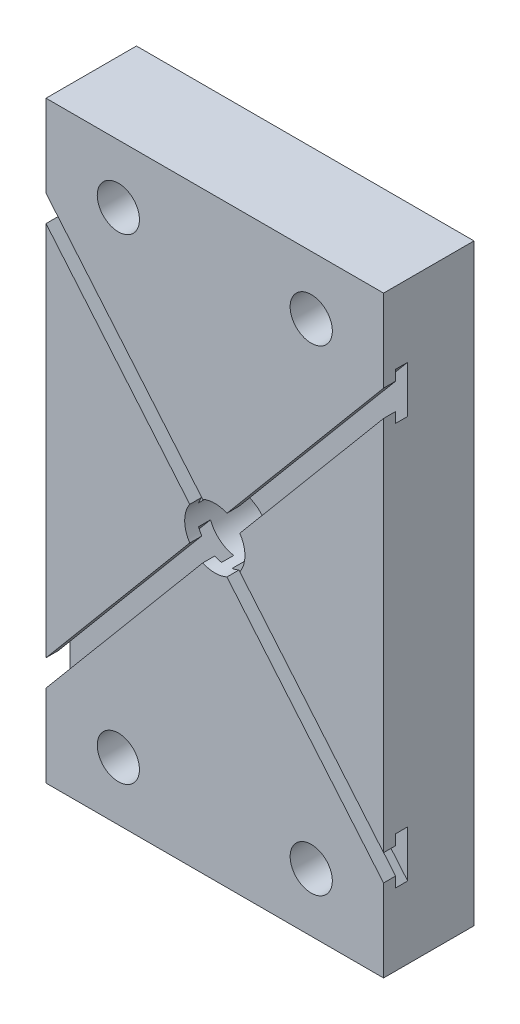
SolidWorks part; units mm, degrees
ref_plane "前视基准面" through (0, 0, 0) normal (0, 0, 1) x (1, 0, 0)
ref_plane "上视基准面" through (0, 0, 0) normal (0, 1, 0) x (1, 0, 0)
ref_plane "右视基准面" through (0, 0, 0) normal (1, 0, 0) x (0, 0, -1)
sketch "草图1" plane through (0, 0, 0) normal (0, 0, 1) x (1, 0, 0)
  line L0 (0, 0) -> (80, 0) construction
  line L1 (140, 246) -> (-140, 246)
  line L2 (140, 246) -> (140, -246)
  line L3 (140, -246) -> (-140, -246)
  line L4 (-140, 246) -> (-140, -246)
  line L5 (140, 246) -> (-140, -246) construction
  line L6 (140, -246) -> (-140, 246) construction
  line L7 (80, 0) -> (80, -197.5) construction
  line L8 (0, 0) -> (0, -157.9605) construction
  circle A0 centre (80, -197.5) radius 17.5
  circle A1 centre (80, 197.5) radius 17.5
  circle A2 centre (-80, -197.5) radius 17.5
  circle A3 centre (-80, 197.5) radius 17.5
  circle A4 centre (0, 0) radius 25
  point P0 (0, 0)
  dimension "D1" = 492
  dimension "D2" = 280
extrude "凸台-拉伸1" add sketch "草图1" along normal blind 75
sketch "草图2" plane through (0, 0, 0) normal (0, 0, -1) x (-1, 0, 0)
  line L1 (-125, 234) -> (125, 234)
  line L2 (-125, 234) -> (-125, -234)
  line L3 (-125, -234) -> (125, -234)
  line L4 (125, 234) -> (125, -234)
  line L5 (-125, 234) -> (125, -234) construction
  line L6 (-125, -234) -> (125, 234) construction
  point P0 (0, 0)
  dimension "D1" = 468
  dimension "D2" = 250
extrude "切除-拉伸1" cut sketch "草图2" against normal blind 50
sketch "草图3" plane through (0, 0, 50) normal (0, 0, -1) x (-1, 0, 0)
  circle A0 centre (0, 0) radius 50
  circle A1 centre (0, 0) radius 25 construction
  circle A2 centre (0, 0) radius 25
extrude "凸台-拉伸2" add sketch "草图3" along normal blind 40
sketch "草图4" plane through (0, 0, 0) normal (1, 0, 0) x (0, 0, -1)
  line L1 (-50, -50) -> (-50, -234)
  line L4 (-30, -234) -> (-50, -234)
  line L5 (-30, 234) -> (-50, 234)
  line L6 (-10, 50) -> (-30, 234)
  line L7 (-30, -234) -> (-10, -50)
  line L8 (-50, 234) -> (-50, -234) construction
  line L9 (-50, 234) -> (-50, 50)
  line L10 (-10, -50) -> (-50, -50)
  line L11 (-10, 50) -> (-50, 50)
extrude "凸台-拉伸5" add sketch "草图4" along normal blind 7.5 and the other way blind 7.5 separate body
sketch "草图5" plane through (0, -50, 0) normal (0, 1, 0) x (1, 0, 0)
  line L4 (-7.5, -50) -> (7.5, -50)
  line L5 (7.5, -50) -> (7.5, -10)
  line L6 (7.5, -10) -> (-7.5, -10)
  line L7 (-7.5, -10) -> (-7.5, -50)
  line L8 (-7.5, -50) -> (7.5, -50)
  line L9 (7.5, -50) -> (7.5, -10)
  line L10 (7.5, -10) -> (-7.5, -10)
  line L11 (-7.5, -10) -> (-7.5, -50)
  dimension "D1" = 0
extrude "凸台-拉伸8" add sketch "草图5" along normal up to next
sketch "草图7" plane through (0, 50, 0) normal (0, -1, 0) x (1, 0, 0)
  line L4 (-7.5, 10) -> (7.5, 10)
  line L5 (7.5, 10) -> (7.5, 50)
  line L6 (7.5, 50) -> (-7.5, 50)
  line L7 (-7.5, 50) -> (-7.5, 10)
  line L8 (-7.5, 10) -> (7.5, 10)
  line L9 (7.5, 10) -> (7.5, 50)
  line L10 (7.5, 50) -> (-7.5, 50)
  line L11 (-7.5, 50) -> (-7.5, 10)
  dimension "D1" = 0
extrude "凸台-拉伸9" add sketch "草图7" along normal up to next
sketch "草图8" plane through (0, 0, 0) normal (0, 1, 0) x (1, 0, 0)
  line L0 (125, -50) -> (7.5, -50) construction
  line L1 (-7.5, -50) -> (-125, -50) construction
  line L2 (125, -50) -> (50, -50)
  line L3 (-50, -50) -> (-125, -50)
  line L4 (-125, -50) -> (-125, -30)
  line L5 (125, -50) -> (125, -30)
  line L8 (-50, -10) -> (-50, -50)
  line L12 (50, -10) -> (50, -50)
  line L13 (-125, -30) -> (-50, -10)
  line L14 (50, -10) -> (125, -30)
  line L15 (125, -30) -> (124.4019, -30.3704)
extrude "凸台-拉伸10" add sketch "草图8" along normal blind 7.5 and the other way blind 7.5 separate body
sketch "草图9" plane through (-50, 0, 0) normal (1, 0, 0) x (0, 0, -1)
  line L4 (-10, -7.5) -> (-10, 7.5)
  line L5 (-10, 7.5) -> (-50, 7.5)
  line L6 (-50, 7.5) -> (-50, -7.5)
  line L7 (-50, -7.5) -> (-10, -7.5)
  line L8 (-10, -7.5) -> (-10, 7.5)
  line L9 (-10, 7.5) -> (-50, 7.5)
  line L10 (-50, 7.5) -> (-50, -7.5)
  line L11 (-50, -7.5) -> (-10, -7.5)
  dimension "D1" = 0
extrude "凸台-拉伸12" add sketch "草图9" along normal up to next
sketch "草图12" plane through (50, 0, 0) normal (-1, 0, 0) x (0, 0, 1)
  line L4 (50, -7.5) -> (50, 7.5)
  line L5 (50, 7.5) -> (10, 7.5)
  line L6 (10, 7.5) -> (10, -7.5)
  line L7 (10, -7.5) -> (50, -7.5)
  line L8 (50, -7.5) -> (50, 7.5)
  line L9 (50, 7.5) -> (10, 7.5)
  line L10 (10, 7.5) -> (10, -7.5)
  line L11 (10, -7.5) -> (50, -7.5)
  dimension "D1" = 0
extrude "凸台-拉伸13" add sketch "草图12" along normal up to next
sketch "草图13" plane through (0, 0, 50) normal (0, 0, -1) x (-1, 0, 0)
  line L0 (0, 0) -> (-89.0115, -106.0798) construction
  line L1 (0, 0) -> (-93.6192, 111.571) construction
  line L2 (0, 0) -> (-93.6192, 0) construction
  line L3 (0, 0) -> (0, -133.5338) construction
  line L5 (125, 121.744) -> (43.5123, 24.6308)
  line L6 (125, 176.1944) -> (16.7008, 47.1284)
  line L7 (-125, 234) -> (-125, -234) construction
  line L8 (125, -234) -> (125, 234) construction
  line L9 (-125, 176.1944) -> (-125, 121.744)
  line L10 (125, -176.1944) -> (125, -121.744)
  line L11 (-16.7008, -47.1284) -> (-125, -176.1944)
  line L12 (-43.5123, -24.6308) -> (-125, -121.744)
  line L14 (125, -176.1944) -> (16.7008, -47.1284)
  line L15 (125, -121.744) -> (43.5123, -24.6308)
  line L16 (-125, -121.744) -> (-125, -176.1944)
  line L17 (125, 121.744) -> (125, 176.1944)
  line L19 (-16.7008, 47.1284) -> (-125, 176.1944)
  line L20 (-43.5123, 24.6308) -> (-125, 121.744)
  arc A0 (7.5, -49.4343) -> (49.4343, -7.5) centre (0, 0) ccw construction
  arc A1 (-49.4343, -7.5) -> (-7.5, -49.4343) centre (0, 0) ccw construction
  arc A2 (-7.5, 49.4343) -> (-49.4343, 7.5) centre (0, 0) ccw construction
  arc A3 (49.4343, 7.5) -> (7.5, 49.4343) centre (0, 0) ccw construction
  arc A4 (16.7008, -47.1284) -> (43.5123, -24.6308) centre (0, 0) ccw
  arc A5 (-43.5123, -24.6308) -> (-16.7008, -47.1284) centre (0, 0) ccw
  arc A6 (-16.7008, 47.1284) -> (-43.5123, 24.6308) centre (0, 0) ccw
  arc A7 (43.5123, 24.6308) -> (16.7008, 47.1284) centre (0, 0) ccw
extrude "凸台-拉伸14" add sketch "草图13" along normal blind 20 separate body
sketch "草图14" plane through (0, 0, 50) normal (0, 0, -1) x (-1, 0, 0)
  line L0 (0, 0) -> (0, -125) construction
  line L1 (0, 0) -> (0, 125) construction
  line L2 (7.5, -234) -> (7.5, -50) construction
  line L3 (88.3361, -132.5) -> (7.5, -132.5)
  line L4 (-7.5, 117.5) -> (-75.7496, 117.5)
  line L5 (75.7496, -117.5) -> (7.5, -117.5)
  line L6 (-7.5, 132.5) -> (-88.3361, 132.5)
  line L7 (100, -132.5) -> (-100, -117.5) construction
  line L8 (100, -117.5) -> (-100, -132.5) construction
  line L9 (75.7496, 117.5) -> (7.5, 117.5)
  line L10 (-7.5, -117.5) -> (-75.7496, -117.5)
  line L11 (88.3361, 132.5) -> (7.5, 132.5)
  line L12 (-7.5, -132.5) -> (-88.3361, -132.5)
  line L13 (95.7978, 117.5) -> (-95.7978, 132.5) construction
  line L14 (95.7978, 132.5) -> (-95.7978, 117.5) construction
  line L15 (-7.5, -234) -> (-7.5, -50) construction
  line L16 (-7.5, 50) -> (-7.5, 234) construction
  line L17 (7.5, 50) -> (7.5, 234) construction
  line L18 (-125, -176.1944) -> (-16.7008, -47.1284) construction
  line L19 (16.7008, -47.1284) -> (125, -176.1944) construction
  line L20 (-16.7008, 47.1284) -> (-125, 176.1944) construction
  line L21 (125, 176.1944) -> (16.7008, 47.1284) construction
  line L22 (7.5, -132.5) -> (7.5, -117.5)
  line L23 (-7.5, -132.5) -> (-7.5, -117.5)
  line L24 (-7.5, 117.5) -> (-7.5, 132.5)
  line L25 (7.5, 117.5) -> (7.5, 132.5)
  line L26 (-88.3361, -132.5) -> (-75.7496, -117.5)
  line L27 (75.7496, -117.5) -> (88.3361, -132.5)
  line L28 (-75.7496, 117.5) -> (-88.3361, 132.5)
  line L29 (88.3361, 132.5) -> (75.7496, 117.5)
  dimension "D1" = 15
  dimension "D2" = 200
  dimension "D3" = 15
extrude "凸台-拉伸16" add sketch "草图14" along normal blind 20 separate body
sketch "草图15" plane through (0, 0, 10) normal (0, 0, -1) x (-1, 0, 0)
  line L0 (0, 0) -> (-99.9637, -119.1321) construction
  line L1 (0, 0) -> (0, -180) construction
  line L2 (0, 0) -> (99.9637, -119.1321) construction
ref_plane "基准面2" through (0, 0, 10) normal (-0.6428, -0.766, 0) x (-0.766, 0.6428, 0)
sketch "草图17" plane through (0, 0, 10) normal (-0.6428, -0.766, 0) x (-0.766, 0.6428, 0)
  line L1 (7, -65) -> (-7, -65)
  line L2 (0, 0) -> (0, -65) construction
  line L3 (-7, -65) -> (-7, -55)
  line L4 (-7, -55) -> (-12.5, -55)
  line L5 (-12.5, -55) -> (-12.5, -45)
  line L6 (-12.5, -45) -> (12.5, -45)
  line L7 (12.5, -55) -> (12.5, -45)
  line L8 (7, -55) -> (12.5, -55)
  line L9 (7, -65) -> (7, -55)
extrude "切除-拉伸3" cut sketch "草图17" against normal through all and the other way through all
ref_plane "基准面3" through (0, 0, 10) normal (0.6428, -0.766, 0) x (-0.766, -0.6428, 0)
sketch "草图18" plane through (0, 0, 10) normal (0.6428, -0.766, 0) x (-0.766, -0.6428, 0)
  line L1 (7, -65) -> (-7, -65)
  line L2 (0, 0) -> (0, -65) construction
  line L3 (-7, -65) -> (-7, -55)
  line L4 (-7, -55) -> (-12.5, -55)
  line L5 (-12.5, -55) -> (-12.5, -45)
  line L6 (-12.5, -45) -> (12.5, -45)
  line L7 (7, -65) -> (7, -55)
  line L8 (7, -55) -> (12.5, -55)
  line L9 (12.5, -55) -> (12.5, -45)
extrude "切除-拉伸4" cut sketch "草图18" against normal through all and the other way through all
hole_wizard "M8 螺纹孔3" positions "草图24" profile "草图25" tap size "M8" standard "ISO"
sketch "草图24" plane through (0, 0, 0) normal (0, 0, -1) x (-1, 0, 0)
  point P0 (132, -237.5)
  point P2 (-132, -237.5)
  point P4 (132, 237.5)
  point P6 (-132, 237.5)
  dimension "D1" = 237.5
  dimension "D2" = 237.5
  dimension "D3" = 475
  dimension "D4" = 475
  dimension "D5" = 132
  dimension "D6" = 132
  dimension "D7" = 264
  dimension "D8" = 264
sketch "草图25" plane through (-132, -237.5, 0) normal (1, 0, 0) x (0, 1, 0)
  line L0 (0, 0) -> (0, 25.7929)
  line L1 (0, 25.7929) -> (3.4, 23.75)
  line L2 (3.4, 23.75) -> (3.4, 0)
  line L5 (3.4, 0) -> (0, 0)
  line L10 (0, 25.7929) -> (-3.4, 23.75) construction
  line L11 (0, -6.35) -> (0, 107.95) construction
  dimension "螺纹孔钻头直径" = 6.8
  dimension "螺纹孔钻头深度" = 23.75
  dimension "导头角度" = 118
